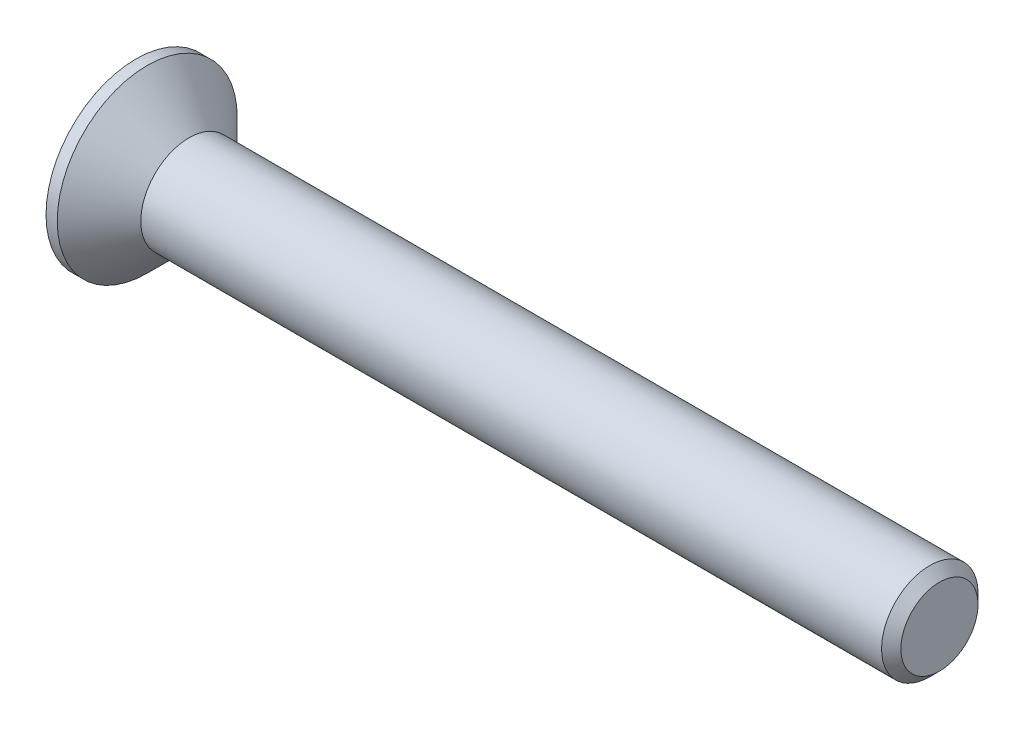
SolidWorks part; units mm, degrees
ref_plane "Front Plane" through (0, 0, 0) normal (0, 0, 1) x (1, 0, 0)
ref_plane "Top Plane" through (0, 0, 0) normal (0, 1, 0) x (1, 0, 0)
ref_plane "Right Plane" through (0, 0, 0) normal (1, 0, 0) x (0, 0, -1)
sketch "Sketch1" plane through (0, 0, 0) normal (0, 0, 1) x (1, 0, 0)
  line L1 (-1.65, 2.8) -> (-1.65, 0)
  line L2 (-1.65, 0) -> (23.35, 0)
  line L3 (23.35, 0) -> (23.35, 1.5)
  line L4 (23.35, 1.5) -> (0, 1.5)
  line L5 (-1.65, 2.8) -> (-1.3, 2.8)
  line L6 (-1.3, 2.8) -> (0, 1.5)
  dimension "D1" = 1.5
  dimension "D2" = 45
  dimension "D3" = 1.65
  dimension "D4" = 25
  dimension "D5" = 2.8
revolve "Revolve1" add sketch "Sketch1" angle 360 about L2
chamfer "Chamfer1" distance 0.3 angle 45 1 edges at (23.35, -1.5, 0)
sketch "Sketch2" plane through (-1.65, 0, 0) normal (-1, 0, 0) x (0, 0, 1)
  line L0 (-0.365, 1.45) -> (0.365, 1.45)
  line L1 (0.365, 1.45) -> (0.365, 0.365)
  line L2 (0.365, 0.365) -> (1.45, 0.365)
  line L3 (1.45, 0.365) -> (1.45, -0.365)
  line L4 (1.45, -0.365) -> (0.365, -0.365)
  line L5 (0.365, -0.365) -> (0.365, -1.45)
  line L6 (0.365, -1.45) -> (-0.365, -1.45)
  line L7 (-0.365, -1.45) -> (-0.365, -0.365)
  line L8 (-0.365, -0.365) -> (-1.45, -0.365)
  line L9 (-1.45, -0.365) -> (-1.45, 0.365)
  line L10 (-1.45, 0.365) -> (-0.365, 0.365)
  line L11 (-0.365, 0.365) -> (-0.365, 1.45)
  point P2 (0, 1.45)
  point P14 (0, -1.45)
  point P15 (1.45, 0)
  point P16 (-1.45, 0)
  dimension "D1" = 2.9
  dimension "D2" = 0.73
extrude "Cut-Extrude1" cut sketch "Sketch2" against normal blind 1.25
